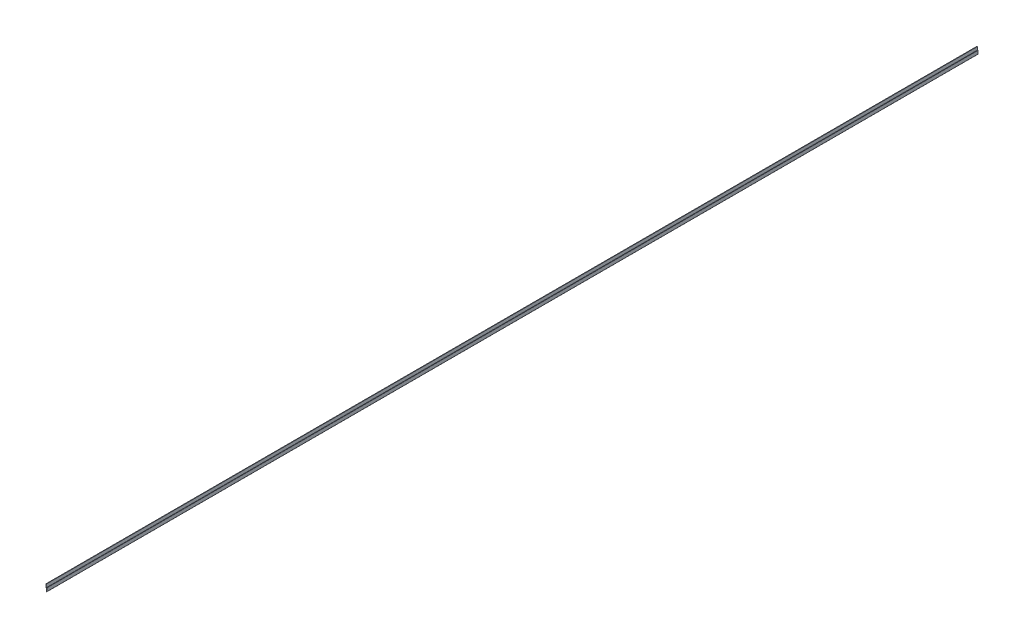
SolidWorks part; units mm, degrees
ref_plane "Front" through (0, 0, 0) normal (0, 0, 1) x (1, 0, 0)
ref_plane "Top" through (0, 0, 0) normal (0, 1, 0) x (1, 0, 0)
ref_plane "Right" through (0, 0, 0) normal (1, 0, 0) x (0, 0, -1)
sketch "Sketch1" plane through (0, 0, 0) normal (0, 0, 1) x (1, 0, 0)
  line L0 (0, 1.016) -> (0, 21.59)
  line L1 (0.9987, 0) -> (0.27, 0) construction
  line L2 (2.0306, 0.9628) -> (2.6089, 11.9977)
  line L3 (1.3413, 12.0752) -> (0.7212, 3.2067)
  line L4 (-0.2539, 21.594) -> (-0.6366, 9.5351)
  line L5 (-0.125, 21.717) -> (-1.8248, 21.717) construction
  line L6 (-0.6366, 9.5351) -> (-4.9319, 9.6714) construction
  line L7 (-0.125, 21.717) -> (-4.4111, 21.853) construction
  line L8 (2.0341, 12.6632) -> (8.8533, 12.3058) construction
  line L9 (0.9987, 0) -> (7.2272, -0.3264) construction
  line L10 (2.0341, 12.6632) -> (13.2424, 11.8794) construction
  line L11 (-0.7617, 21.6102) -> (-1.1444, 9.5512) construction
  arc A0 (0, 1.016) -> (2.0306, 0.9628) centre (1.016, 1.016) ccw
  arc A1 (2.6089, 11.9977) -> (1.3413, 12.0752) centre (1.9748, 12.0309) ccw
  arc A2 (0, 21.59) -> (-0.2539, 21.594) centre (-0.127, 21.59) ccw
  arc A3 (0.508, 1.016) -> (1.5233, 0.9894) centre (1.016, 1.016) ccw construction
  arc A4 (2.1016, 12.0243) -> (1.8481, 12.0398) centre (1.9748, 12.0309) ccw construction
  point P15 (1.9801, 0)
  point P18 (0, 0)
  dimension "D5" = 0.635
  dimension "D3" = 0.508
  dimension "D4" = 12.192
  dimension "D2" = 1.016
  dimension "D9" = 0.127
  dimension "D1" = 21.717
  dimension "D6" = 3
  dimension "D7" = 3.175
  dimension "D8" = 1
  dimension "D10" = 12.7
  dimension "D12" = 9.525
  dimension "D11" = 0.508
  dimension "D13" = 0.508
extrude "Extrude-Thin1" add sketch "Sketch1" along normal blind 3048 thin
